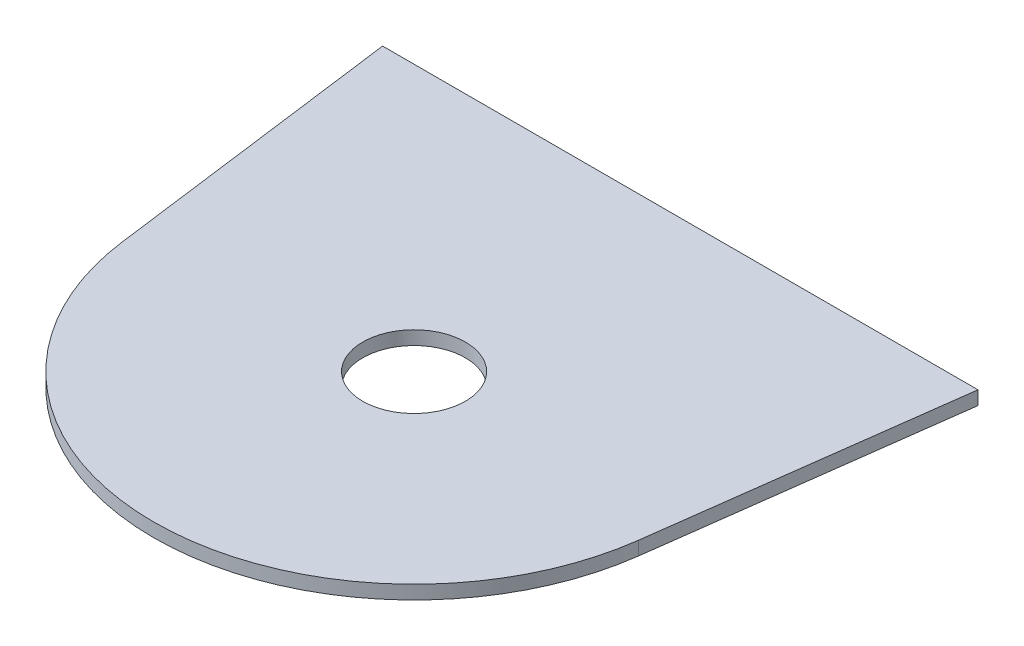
SolidWorks part; units mm, degrees
ref_plane "Plan de face" through (0, 0, 0) normal (0, 0, 1) x (1, 0, 0)
ref_plane "Plan de dessus" through (0, 0, 0) normal (0, 1, 0) x (1, 0, 0)
ref_plane "Plan de droite" through (0, 0, 0) normal (1, 0, 0) x (0, 0, -1)
imported_body "Importée1"
sketch "Esquisse1" plane through (0, 2, 0) normal (0, 1, 0) x (1, 0, 0)
  circle A0 centre (0, 0) radius 7.5
  dimension "D1" = 15
extrude "Enlèv. mat.-Extru.1" cut sketch "Esquisse1" against normal through all
